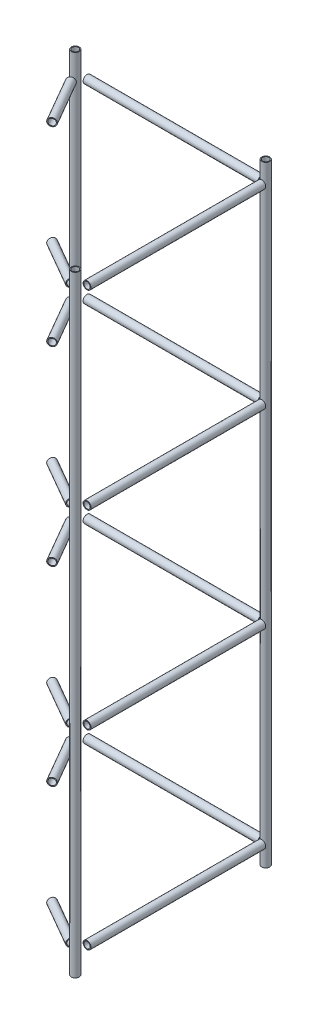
SolidWorks part; units mm, degrees
ref_plane "Front Plane" through (0, 0, 0) normal (0, 0, 1) x (1, 0, 0)
ref_plane "Top Plane" through (0, 0, 0) normal (0, 1, 0) x (1, 0, 0)
ref_plane "Right Plane" through (0, 0, 0) normal (1, 0, 0) x (0, 0, -1)
sketch3d "3DSketch1"
  line L0 (0, 0, 0) -> (0, 977.9, 0)
  line L1 (0, 31.75, 0) -> (-304.8, 31.75, 0)
  line L2 (0, 31.75, 0) -> (0, 31.75, 304.8)
  line L3 (0, 336.55, 0) -> (-304.8, 336.55, 0)
  line L4 (0, 336.55, 0) -> (0, 336.55, 304.8)
  line L5 (0, 641.35, 0) -> (0, 641.35, 304.8)
  line L6 (0, 641.35, 0) -> (-304.8, 641.35, 0)
  line L7 (0, 0, 304.8) -> (0, 977.9, 304.8)
  line L8 (-304.8, 977.9, 0) -> (-304.8, 0, 0)
  line L9 (-304.8, 31.75, 0) -> (-254.1016, 31.75, 87.8122)
  line L10 (0, 31.75, 304.8) -> (-87.8122, 31.75, 254.1016)
  line L11 (-304.8, 336.55, 0) -> (-254.1016, 336.55, 87.8122)
  line L12 (0, 336.55, 304.8) -> (-87.8122, 336.55, 254.1016)
  line L13 (0, 641.35, 304.8) -> (-87.8122, 641.35, 254.1016)
  line L14 (-304.8, 641.35, 0) -> (-254.1016, 641.35, 87.8122)
  line L15 (-304.8, 946.15, 0) -> (-254.1016, 946.15, 87.8122)
  line L16 (0, 946.15, 304.8) -> (-87.8122, 946.15, 254.1016)
  line L17 (-304.8, 946.15, 0) -> (0, 946.15, 0)
  line L18 (0, 946.15, 304.8) -> (0, 946.15, 0)
  dimension "D1" = 31.75
  dimension "D3" = 304.8
  dimension "D2" = 977.9
  dimension "D4" = 304.8
  dimension "D5" = 304.8
  dimension "D6" = 101.3968
  dimension "D7" = 60
  dimension "D8" = 60
  dimension "D9" = 90
  dimension "D10" = 90
  dimension "D11" = 304.8
  dimension "D12" = 304.8
other "Structural Member1"
ref_plane "Plane1" through (0, 0, 0) normal (0, 1, 0) x (1, 0, 0)
sketch "Sketch1" plane through (0, 0, 0) normal (0, 1, 0) x (1, 0, 0)
  circle A0 centre (0, 0) radius 5.08
  circle A1 centre (0, 0) radius 6.35
  point P3 (0, 0)
  dimension "In_dia" = 10.16
  dimension "Out_dia" = 12.7
sketch "Sketch3" plane through (0, 0, 0) normal (0, 1, 0) x (1, 0, 0)
  line L0 (-329.9572, -36.2755) -> (-285.9631, -10.8755)
  line L1 (-285.9631, -10.8755) -> (-285.9631, 39.9245)
  line L2 (-258.501, -90.3522) -> (-249.7022, -85.2722) construction
  circle A0 centre (-304.8, 0) radius 5.08 construction
  dimension "D1" = 18.8369
  dimension "D2" = 18.8369
  dimension "D3" = 50.8
extrude "Cut-Extrude1" cut sketch "Sketch3" against normal through all and the other way through all
sketch "Sketch4" plane through (0, 0, 0) normal (0, 1, 0) x (1, 0, 0)
  line L0 (-6.35, 44.45) -> (-6.35, -6.35)
  line L1 (-6.35, -6.35) -> (44.45, -6.35)
  circle A0 centre (0, 0) radius 6.35 construction
  dimension "D1" = 50.8
extrude "Cut-Extrude2" cut sketch "Sketch4" against normal through all and the other way through all
sketch "Sketch5" plane through (0, 0, 0) normal (0, 1, 0) x (1, 0, 0)
  line L0 (-10.8755, -285.9631) -> (39.9245, -285.9631)
  line L1 (-10.8755, -285.9631) -> (-36.2755, -329.9572)
  line L2 (-84.6372, -248.6023) -> (-90.9872, -259.6009) construction
  circle A0 centre (0, -304.8) radius 5.08 construction
  dimension "D1" = 18.8369
  dimension "D2" = 18.8369
  dimension "D3" = 50.8
extrude "Cut-Extrude3" cut sketch "Sketch5" against normal through all and the other way through all
